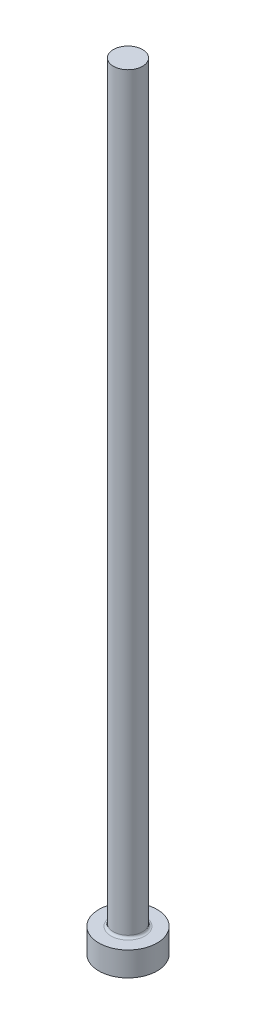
SolidWorks part; units mm, degrees
ref_plane "Plano frontal" through (0, 0, 0) normal (0, 0, 1) x (1, 0, 0)
ref_plane "Plano superior" through (0, 0, 0) normal (0, 1, 0) x (1, 0, 0)
ref_plane "Plano direito" through (0, 0, 0) normal (1, 0, 0) x (0, 0, -1)
sketch "Esboço1" plane through (0, 0, 0) normal (0, 0, 1) x (1, 0, 0)
  line L0 (0, 0) -> (6, 0)
  line L1 (6, 0) -> (6, 5)
  line L2 (6, 5) -> (3.5, 5)
  line L3 (3, 5.5) -> (3, 160)
  line L4 (3, 160) -> (0, 160)
  line L5 (0, 160) -> (0, 0) construction
  line L6 (0, 0) -> (0, 160)
  arc A0 (3.5, 5) -> (3, 5.5) centre (3.5, 5.5) cw
  dimension "D3" = 0.5
  dimension "D1" = 12
  dimension "D2" = 6
  dimension "D4" = 5
  dimension "D5" = 160
revolve "Revolução1" add sketch "Esboço1" angle 360 about L5
sketch "Esboço2"
  dimension "D1" = 3.225
  dimension "D2" = 1.05
  dimension "D3" = 0.675
  dimension "D4" = 0.45
wrap "Envolver1" sketch "Esboço2" wrap type deboss source sketch "Esboço2" thickness 0.1 parameters "D1"=0.1
